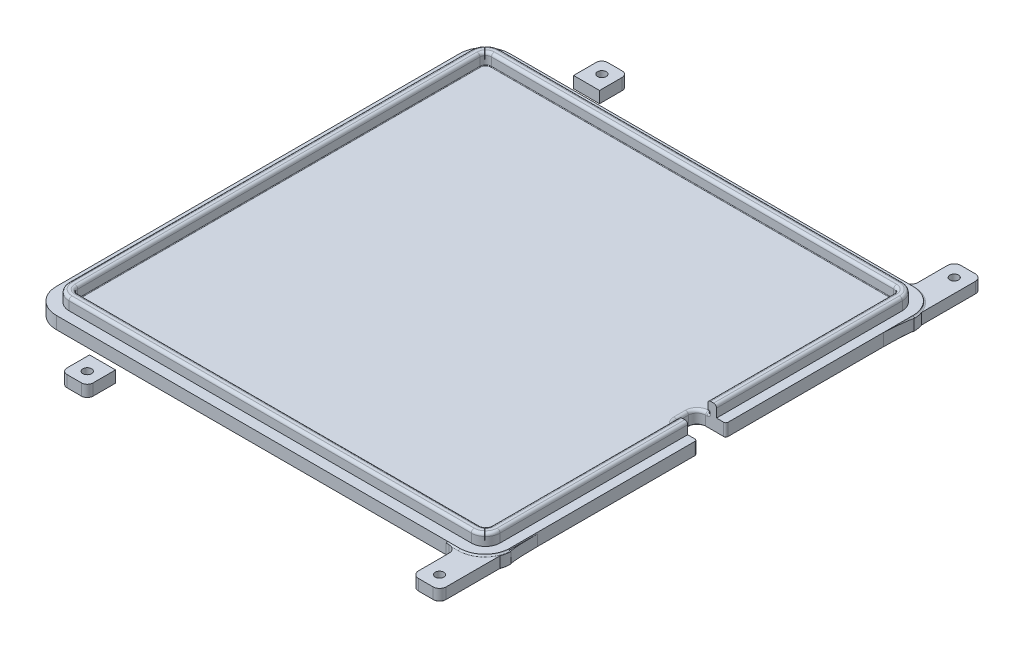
SolidWorks part; units mm, degrees
ref_plane "Front Plane" through (0, 0, 0) normal (0, 0, 1) x (1, 0, 0)
ref_plane "Top Plane" through (0, 0, 0) normal (0, 1, 0) x (1, 0, 0)
ref_plane "Right Plane" through (0, 0, 0) normal (1, 0, 0) x (0, 0, -1)
sketch "Sketch1" plane through (0, 0, 0) normal (0, 1, 0) x (1, 0, 0)
  line L8 (-70, -78.7) -> (70, -78.7)
  line L9 (78.7, -70) -> (78.7, 70)
  line L10 (70, 78.7) -> (-70, 78.7)
  line L11 (-78.7, 70) -> (-78.7, -70)
  line L12 (-70, 70) -> (70, -70) construction
  line L13 (70, -70) -> (70, 70) construction
  line L14 (70, 70) -> (-70, -70) construction
  arc A8 (-78.7, -70) -> (-70, -78.7) centre (-70, -70) ccw
  arc A9 (70, -78.7) -> (78.7, -70) centre (70, -70) ccw
  arc A10 (78.7, 70) -> (70, 78.7) centre (70, 70) ccw
  arc A11 (-70, 78.7) -> (-78.7, 70) centre (-70, 70) ccw
  point P13 (0, 0)
  dimension "D1" = 140
  dimension "D2" = 140
extrude "Boss-Extrude1" add sketch "Sketch1" along normal blind 4.5
sketch "Sketch2" plane through (0, 4.5, 0) normal (0, 1, 0) x (1, 0, 0)
  line L0 (-74.1708, 69.5068) -> (-74.1708, -70.1199)
  line L9 (-69.1708, -75.1199) -> (70.4559, -75.1199)
  line L12 (75.4559, -70.1199) -> (75.4559, 69.5068)
  line L15 (70.4559, 74.5068) -> (-69.1708, 74.5068)
  arc A11 (-74.1708, -70.1199) -> (-69.1708, -75.1199) centre (-69.1708, -70.1199) ccw
  arc A12 (75.4559, -70.1199) -> (70.4559, -75.1199) centre (70.4559, -70.1199) cw
  arc A13 (75.4559, 69.5068) -> (70.4559, 74.5068) centre (70.4559, 69.5068) ccw
  arc A14 (-74.1708, 69.5068) -> (-69.1708, 74.5068) centre (-69.1708, 69.5068) cw
  point P0 (0, 0)
  dimension "D1" = 5
extrude "Extrude-Thin1" add sketch "Sketch2" along normal blind 4 thin
fillet "Fillet1" radius 1 16 edges at (-71.1708, 8.5, 0.3065) (0.6426, 8.5, 72.1199) (72.4559, 8.5, 0.3065) (0.6426, 8.5, -71.5068) (0.6426, 8.5, -74.5068) (75.4559, 8.5, 0.3065) (0.6426, 8.5, 75.1199) (-74.1708, 8.5, 0.3065) (71.8701, 8.5, 71.5341) (71.8701, 8.5, -70.921) (-70.585, 8.5, -70.921) (-70.585, 8.5, 71.5341) (-72.7063, 8.5, -73.0423) (73.9915, 8.5, -73.0423) (73.9915, 8.5, 73.6554) (-72.7063, 8.5, 73.6554)
sketch "Sketch3" plane through (0, 8.5, 0) normal (0, 1, 0) x (1, 0, 0)
  line L0 (-75, 70) -> (-75, 75) construction
  line L1 (-70, 75) -> (-75, 75) construction
  line L2 (-75.0707, 74.9293) -> (-74.9293, 75.0707) construction
  line L3 (-75.0707, 74.9293) -> (78.5176, -78.659)
  line L4 (78.5176, -78.659) -> (78.659, -78.5176)
  line L5 (78.659, -78.5176) -> (-74.9293, 75.0707)
  line L6 (-74.9293, 75.0707) -> (-75.0707, 74.9293)
  point P10 (-75, 75)
extrude "Cut-Extrude1" cut sketch "Sketch3" against normal blind 3.8 draft 2.5
fillet "Fillet2" radius 0.2 8 edges at (-71.1708, 4.5, 0.3065) (-70.585, 4.5, -70.921) (0.6426, 4.5, -71.5068) (71.8701, 4.5, -70.921) (72.4559, 4.5, 0.3065) (71.8701, 4.5, 71.5341) (0.6426, 4.5, 72.1199) (-70.585, 4.5, 71.5341)
sketch "Sketch4" plane through (0, 0, 0) normal (0, -1, 0) x (1, 0, 0)
  line L63 (-66.7883, -91.5032) -> (-66.7883, -78.3901)
  line L64 (-66.7883, -78.3901) -> (-64.3539, -78.3901)
  line L65 (-64.3539, -78.3901) -> (-64.3539, -77.9901)
  line L66 (-64.3539, -77.9901) -> (-67.6539, -77.9901)
  line L67 (-67.6539, -77.9901) -> (-67.6539, -76.1401)
  line L68 (-67.6539, -76.1401) -> (-64.3539, -76.1401)
  line L69 (-64.3539, -76.1401) -> (65.9461, -76.1401)
  line L70 (65.9461, -76.1401) -> (68.9461, -76.1401)
  line L71 (68.9461, -76.1401) -> (68.9461, -77.9901)
  line L72 (68.9461, -77.9901) -> (65.9461, -77.9901)
  line L73 (65.9461, -77.9901) -> (65.6461, -77.9901)
  line L74 (65.6461, -77.9901) -> (65.6461, -78.3901)
  line L75 (65.6461, -78.3901) -> (69.1461, -78.3901)
  line L76 (69.1461, -78.3901) -> (69.1461, -91.5032)
  line L77 (71.4461, -93.8032) -> (76.4678, -93.8032)
  line L78 (78.7678, -91.5032) -> (78.7678, -72.8087)
  line L79 (79.3459, -69.6901) -> (79.3459, -64.6901)
  line L80 (79.3459, -64.6901) -> (78.9459, -64.6901)
  line L81 (78.9459, -64.6901) -> (78.9459, -64.9901)
  line L82 (78.9459, -64.9901) -> (78.9459, -67.9901)
  line L83 (78.9459, -67.9901) -> (77.0959, -67.9901)
  line L84 (77.0959, -67.9901) -> (77.0959, -64.9901)
  line L85 (77.0959, -64.9901) -> (77.0959, 65.6099)
  line L86 (77.0959, 65.6099) -> (77.0959, 68.6099)
  line L87 (77.0959, 68.6099) -> (78.9459, 68.6099)
  line L88 (78.9459, 68.6099) -> (78.9459, 65.6099)
  line L89 (78.9459, 65.6099) -> (78.9459, 65.3099)
  line L90 (78.9459, 65.3099) -> (79.3459, 65.3099)
  line L91 (79.3459, 65.3099) -> (79.3459, 70.3099)
  line L92 (78.7678, 73.4284) -> (78.7678, 92.1229)
  line L93 (76.4678, 94.4229) -> (71.4461, 94.4229)
  line L94 (69.1461, 92.1229) -> (69.1461, 79.0099)
  line L95 (69.1461, 79.0099) -> (65.6461, 79.0099)
  line L96 (65.6461, 79.0099) -> (65.6461, 78.6099)
  line L97 (65.6461, 78.6099) -> (65.9461, 78.6099)
  line L98 (65.9461, 78.6099) -> (68.9461, 78.6099)
  line L99 (68.9461, 78.6099) -> (68.9461, 76.7599)
  line L100 (68.9461, 76.7599) -> (65.9461, 76.7599)
  line L101 (65.9461, 76.7599) -> (-64.6539, 76.7599)
  line L102 (-64.6539, 76.7599) -> (-67.6539, 76.7599)
  line L103 (-67.6539, 76.7599) -> (-67.6539, 78.6099)
  line L104 (-67.6539, 78.6099) -> (-64.6539, 78.6099)
  line L105 (-64.6539, 78.6099) -> (-64.3539, 78.6099)
  line L106 (-64.3539, 78.6099) -> (-64.3539, 79.0099)
  line L107 (-64.3539, 79.0099) -> (-66.7883, 79.0099)
  line L108 (-66.7883, 79.0099) -> (-66.7883, 92.1229)
  line L109 (-69.0883, 94.4229) -> (-74.1099, 94.4229)
  line L110 (-76.4099, 92.1229) -> (-76.4099, 75.3996)
  line L111 (-78.0541, 70.3099) -> (-78.0541, 65.3099)
  line L112 (-78.0541, 65.3099) -> (-77.6541, 65.3099)
  line L113 (-77.6541, 65.3099) -> (-77.6541, 65.6099)
  line L114 (-77.6541, 65.6099) -> (-77.6541, 68.6099)
  line L115 (-77.6541, 68.6099) -> (-75.8041, 68.6099)
  line L116 (-75.8041, 68.6099) -> (-75.8041, 65.6099)
  line L117 (-75.8041, 65.6099) -> (-75.8041, -64.9901)
  line L118 (-75.8041, -64.9901) -> (-75.8041, -67.9901)
  line L119 (-75.8041, -67.9901) -> (-77.6541, -67.9901)
  line L120 (-77.6541, -67.9901) -> (-77.6541, -64.9901)
  line L121 (-77.6541, -64.9901) -> (-77.6541, -64.8901)
  line L122 (-77.6541, -64.8901) -> (-78.0541, -64.8901)
  line L123 (-78.0541, -64.8901) -> (-78.0541, -69.6901)
  line L124 (-76.4099, -74.7799) -> (-76.4099, -91.5032)
  line L125 (-74.1099, -93.8032) -> (-69.0883, -93.8032)
  line L126 (-66.7883, -91.5032) -> (-66.7883, -78.3901)
  line L127 (-66.7883, -78.3901) -> (-64.3539, -78.3901)
  line L128 (-64.3539, -78.3901) -> (-64.3539, -77.9901)
  line L129 (-64.3539, -77.9901) -> (-67.6539, -77.9901)
  line L130 (-67.6539, -77.9901) -> (-67.6539, -76.1401)
  line L131 (-67.6539, -76.1401) -> (-64.3539, -76.1401)
  line L132 (-64.3539, -76.1401) -> (65.9461, -76.1401)
  line L133 (65.9461, -76.1401) -> (68.9461, -76.1401)
  line L134 (68.9461, -76.1401) -> (68.9461, -77.9901)
  line L135 (68.9461, -77.9901) -> (65.9461, -77.9901)
  line L136 (65.9461, -77.9901) -> (65.6461, -77.9901)
  line L137 (65.6461, -77.9901) -> (65.6461, -78.3901)
  line L138 (65.6461, -78.3901) -> (69.1461, -78.3901)
  line L139 (69.1461, -78.3901) -> (69.1461, -91.5032)
  line L140 (71.4461, -93.8032) -> (76.4678, -93.8032)
  line L141 (78.7678, -91.5032) -> (78.7678, -72.8087)
  line L142 (79.3459, -69.6901) -> (79.3459, -64.6901)
  line L143 (79.3459, -64.6901) -> (78.9459, -64.6901)
  line L144 (78.9459, -64.6901) -> (78.9459, -64.9901)
  line L145 (78.9459, -64.9901) -> (78.9459, -67.9901)
  line L146 (78.9459, -67.9901) -> (77.0959, -67.9901)
  line L147 (77.0959, -67.9901) -> (77.0959, -64.9901)
  line L148 (77.0959, -64.9901) -> (77.0959, 65.6099)
  line L149 (77.0959, 65.6099) -> (77.0959, 68.6099)
  line L150 (77.0959, 68.6099) -> (78.9459, 68.6099)
  line L151 (78.9459, 68.6099) -> (78.9459, 65.6099)
  line L152 (78.9459, 65.6099) -> (78.9459, 65.3099)
  line L153 (78.9459, 65.3099) -> (79.3459, 65.3099)
  line L154 (79.3459, 65.3099) -> (79.3459, 70.3099)
  line L155 (78.7678, 73.4284) -> (78.7678, 92.1229)
  line L156 (76.4678, 94.4229) -> (71.4461, 94.4229)
  line L157 (69.1461, 92.1229) -> (69.1461, 79.0099)
  line L158 (69.1461, 79.0099) -> (65.6461, 79.0099)
  line L159 (65.6461, 79.0099) -> (65.6461, 78.6099)
  line L160 (65.6461, 78.6099) -> (65.9461, 78.6099)
  line L161 (65.9461, 78.6099) -> (68.9461, 78.6099)
  line L162 (68.9461, 78.6099) -> (68.9461, 76.7599)
  line L163 (68.9461, 76.7599) -> (65.9461, 76.7599)
  line L164 (65.9461, 76.7599) -> (-64.6539, 76.7599)
  line L165 (-64.6539, 76.7599) -> (-67.6539, 76.7599)
  line L166 (-67.6539, 76.7599) -> (-67.6539, 78.6099)
  line L167 (-67.6539, 78.6099) -> (-64.6539, 78.6099)
  line L168 (-64.6539, 78.6099) -> (-64.3539, 78.6099)
  line L169 (-64.3539, 78.6099) -> (-64.3539, 79.0099)
  line L170 (-64.3539, 79.0099) -> (-66.7883, 79.0099)
  line L171 (-66.7883, 79.0099) -> (-66.7883, 92.1229)
  line L172 (-69.0883, 94.4229) -> (-74.1099, 94.4229)
  line L173 (-76.4099, 92.1229) -> (-76.4099, 75.3996)
  line L174 (-78.0541, 70.3099) -> (-78.0541, 65.3099)
  line L175 (-78.0541, 65.3099) -> (-77.6541, 65.3099)
  line L176 (-77.6541, 65.3099) -> (-77.6541, 65.6099)
  line L177 (-77.6541, 65.6099) -> (-77.6541, 68.6099)
  line L178 (-77.6541, 68.6099) -> (-75.8041, 68.6099)
  line L179 (-75.8041, 68.6099) -> (-75.8041, 65.6099)
  line L180 (-75.8041, 65.6099) -> (-75.8041, -64.9901)
  line L181 (-75.8041, -64.9901) -> (-75.8041, -67.9901)
  line L182 (-75.8041, -67.9901) -> (-77.6541, -67.9901)
  line L183 (-77.6541, -67.9901) -> (-77.6541, -64.9901)
  line L184 (-77.6541, -64.9901) -> (-77.6541, -64.8901)
  line L185 (-77.6541, -64.8901) -> (-78.0541, -64.8901)
  line L186 (-78.0541, -64.8901) -> (-78.0541, -69.6901)
  line L187 (-76.4099, -74.7799) -> (-76.4099, -91.5032)
  line L188 (-74.1099, -93.8032) -> (-69.0883, -93.8032)
  arc A12 (69.1461, -91.5032) -> (71.4461, -93.8032) centre (71.4461, -91.5032) ccw
  arc A13 (76.4678, -93.8032) -> (78.7678, -91.5032) centre (76.4678, -91.5032) ccw
  arc A14 (78.7678, -72.8087) -> (79.3459, -69.6901) centre (70.6459, -69.6901) ccw
  arc A15 (79.3459, 70.3099) -> (78.7678, 73.4284) centre (70.6459, 70.3099) ccw
  arc A16 (78.7678, 92.1229) -> (76.4678, 94.4229) centre (76.4678, 92.1229) ccw
  arc A17 (71.4461, 94.4229) -> (69.1461, 92.1229) centre (71.4461, 92.1229) ccw
  arc A18 (-66.7883, 92.1229) -> (-69.0883, 94.4229) centre (-69.0883, 92.1229) ccw
  arc A19 (-74.1099, 94.4229) -> (-76.4099, 92.1229) centre (-74.1099, 92.1229) ccw
  arc A20 (-76.4099, 75.3996) -> (-78.0541, 70.3099) centre (-69.3541, 70.3099) ccw
  arc A21 (-78.0541, -69.6901) -> (-76.4099, -74.7799) centre (-69.3541, -69.6901) ccw
  arc A22 (-76.4099, -91.5032) -> (-74.1099, -93.8032) centre (-74.1099, -91.5032) ccw
  arc A23 (-69.0883, -93.8032) -> (-66.7883, -91.5032) centre (-69.0883, -91.5032) ccw
  arc A24 (69.1461, -91.5032) -> (71.4461, -93.8032) centre (71.4461, -91.5032) ccw
  arc A25 (76.4678, -93.8032) -> (78.7678, -91.5032) centre (76.4678, -91.5032) ccw
  arc A26 (78.7678, -72.8087) -> (79.3459, -69.6901) centre (70.6459, -69.6901) ccw
  arc A27 (79.3459, 70.3099) -> (78.7678, 73.4284) centre (70.6459, 70.3099) ccw
  arc A28 (78.7678, 92.1229) -> (76.4678, 94.4229) centre (76.4678, 92.1229) ccw
  arc A29 (71.4461, 94.4229) -> (69.1461, 92.1229) centre (71.4461, 92.1229) ccw
  arc A30 (-66.7883, 92.1229) -> (-69.0883, 94.4229) centre (-69.0883, 92.1229) ccw
  arc A31 (-74.1099, 94.4229) -> (-76.4099, 92.1229) centre (-74.1099, 92.1229) ccw
  arc A32 (-76.4099, 75.3996) -> (-78.0541, 70.3099) centre (-69.3541, 70.3099) ccw
  arc A33 (-78.0541, -69.6901) -> (-76.4099, -74.7799) centre (-69.3541, -69.6901) ccw
  arc A34 (-76.4099, -91.5032) -> (-74.1099, -93.8032) centre (-74.1099, -91.5032) ccw
  arc A35 (-69.0883, -93.8032) -> (-66.7883, -91.5032) centre (-69.0883, -91.5032) ccw
  dimension "D1" = 0
extrude "Boss-Extrude2" add sketch "Sketch4" against normal blind 4
fillet "Fillet4" radius 0.5 5 edges at (-70, 4.25, 78.7) (-67.1769, 4, 78.7) (-73.5009, 4, 77.9645) (-64.3539, 4, 78.8549) (-65.5711, 4, 79.0099)
fillet "Fillet6" radius 0.5 9 edges at (78.7, 4.25, 70) (70, 4.25, 78.7) (76.1518, 4, 76.1518) (67.8231, 4, 78.7) (78.7, 4, 69.3049) (65.6461, 4, 78.8549) (78.823, 4, 68.6099) (67.3961, 4, 79.0099) (78.9459, 4, 66.9599)
fillet "Fillet7" radius 0.5 7 edges at (70, 4.25, -78.7) (78.7, 4.25, -70) (76.1518, 4, -76.1518) (78.7, 4, -68.9951) (69.5731, 4, -78.7) (78.823, 4, -67.9901) (78.9459, 4, -66.3401)
fillet "Fillet8" radius 0.5 3 edges at (-70, 4.25, -78.7) (-73.5009, 4, -77.9645) (-68.3941, 4, -78.7)
fillet "Fillet9" radius 2.5 6 edges at (-76.4099, 2.25, 75.8824) (-66.7883, 2.0188, 79.0099) (69.1461, 2.0188, 79.0099) (69.1461, 2.25, -78.7) (-66.7883, 2.25, -78.7) (-76.4099, 2.25, -75.8824)
sketch "Sketch5" plane through (0, 0, 0) normal (0, -1, 0) x (1, 0, 0)
  circle A0 centre (-71.5991, -89.0032) radius 1.5 construction
  circle A1 centre (73.957, -89.0032) radius 1.5 construction
  circle A2 centre (73.957, 89.6229) radius 1.5 construction
  circle A3 centre (-71.5991, 89.6229) radius 1.5 construction
  circle A4 centre (-71.5991, -89.0032) radius 1.5
  circle A5 centre (73.957, -89.0032) radius 1.5
  circle A6 centre (73.957, 89.6229) radius 1.5
  circle A7 centre (-71.5991, 89.6229) radius 1.5
extrude "Cut-Extrude2" cut sketch "Sketch5" against normal blind 4
sketch "Sketch6" plane through (78.7, 0, 0) normal (1, 0, 0) x (0, 0, -1)
  line L0 (-5, 0) -> (5, 0) construction
  line L4 (-5, 0) -> (5, 0)
  line L5 (-5, 0) -> (-5, 8.5)
  line L6 (-5, 8.5) -> (5, 8.5)
  line L7 (5, 0) -> (5, 8.5)
  line L8 (-5, 0) -> (5, 8.5) construction
  line L9 (-5, 8.5) -> (5, 0) construction
  line L10 (-70.1199, 8.5) -> (69.5068, 8.5) construction
  line L11 (-68.6099, 0) -> (67.9901, 0) construction
  point P6 (0, 0)
  point P10 (0, 4.25)
  dimension "D1" = 10
extrude "Cut-Extrude3" cut sketch "Sketch6" against normal blind 10
fillet "Fillet10" radius 3 2 edges at (68.7, 2.25, 5) (68.7, 2.25, -5)
fillet "Fillet11" radius 0.75 2 edges at (78.7, 2.25, -5) (78.7, 2.25, 5)
fillet "Fillet12" radius 1 3 edges at (69.5787, 4.5, -4.1213) (69.5787, 4.5, 4.1213) (68.7, 4.5, 0)
sketch "Sketch7" plane through (0, 4.5, 0) normal (0, 1, 0) x (1, 0, 0)
  line L0 (79.3459, 69.6901) -> (79.3459, 64.6901) construction
  line L1 (78.7, 69.6901) -> (79.3459, 69.6901)
  line L2 (78.7, 69.6901) -> (78.7, 63.8052)
  line L3 (78.7, 63.8052) -> (79.3459, 63.8052)
  line L4 (79.3459, 69.6901) -> (79.3459, 63.8052)
  line L5 (78.7, 69.6901) -> (79.3459, 63.8052) construction
  line L6 (78.7, 63.8052) -> (79.3459, 69.6901) construction
  line L7 (78.7, -70.3099) -> (79.3459, -70.3099)
  line L8 (78.7, -70.3099) -> (78.7, -64.458)
  line L9 (78.7, -64.458) -> (79.3459, -64.458)
  line L10 (79.3459, -70.3099) -> (79.3459, -64.458)
  line L11 (78.7, -70.3099) -> (79.3459, -64.458) construction
  line L12 (78.7, -64.458) -> (79.3459, -70.3099) construction
  line L13 (79.3459, 69.6901) -> (79.3459, 64.6901) construction
  line L14 (79.3459, -65.3099) -> (79.3459, -70.3099) construction
  line L15 (79.3459, -65.3099) -> (79.3459, -70.3099) construction
  line L16 (78.7, -68.6099) -> (78.7, -5.75) construction
  line L17 (78.7, 67.9901) -> (78.7, 70) construction
  point P4 (79.023, 66.7477)
  point P10 (79.023, -67.3839)
extrude "Cut-Extrude4" cut sketch "Sketch7" against normal blind 10
fillet "Fillet17" radius 10 2 edges at (78.7, 0, 38.0299) (79.023, 0, 70.3099)
fillet "Fillet19" radius 10 4 edges at (79.273, 4, -69.6901) (79.023, 0, -69.6901) (78.7, 2.25, -69.6901) (78.8464, 4.1464, -69.6901)
sketch "Sketch8" plane through (0, 4.5, 0) normal (0, 1, 0) x (1, 0, 0)
  line L0 (-64.3539, -78.7) -> (-70, -78.7)
  line L1 (-76.4174, -76.5921) -> (-76.4174, -98.7294)
  line L2 (-76.4174, -98.7294) -> (-59.4049, -98.7294)
  line L3 (-59.4049, -98.7294) -> (-59.4049, -78.7)
  line L4 (-64.3539, -78.7) -> (65.6461, -78.7) construction
  line L5 (-59.4049, -78.7) -> (-64.3539, -78.7)
  line L6 (-64.2883, 78.7) -> (-64.2883, 95.5579)
  line L7 (-64.2883, 95.5579) -> (-76.574, 95.5579)
  line L8 (-76.574, 95.5579) -> (-76.9211, 75.2715)
  line L9 (-64.2883, 78.7) -> (-70, 78.7) construction
  line L10 (-64.2883, 78.7) -> (-70, 78.7)
  arc A0 (-76.9211, -75.2715) -> (-70, -78.7) centre (-70, -70) ccw construction
  arc A1 (-76.9211, -75.2715) -> (-70, -78.7) centre (-70, -70) ccw
  arc A2 (-76.4174, -76.5921) -> (-76.9211, -75.2715) centre (-78.9099, -76.7863) ccw construction
  arc A3 (-76.4174, -76.5921) -> (-76.9211, -75.2715) centre (-78.9099, -76.7863) ccw
  arc A4 (-70, 78.7) -> (-76.9211, 75.2715) centre (-70, 70) ccw construction
  arc A5 (-70, 78.7) -> (-76.9211, 75.2715) centre (-70, 70) ccw
extrude "Cut-Extrude5" cut sketch "Sketch8" against normal blind 10
chamfer "Chamfer1" distance 0.2 angle 45 34 edges at (73.957, 0, -90.5032) (73.957, 0, 88.1229) (78.7678, 0, -82.1559) (78.0941, 0, -93.1295) (73.957, 0, -93.8032) (69.8198, 0, -93.1295) (69.1461, 0, -86.3516) (68.4139, 0, -79.4322) (-1.6769, 0, -78.7) (-76.1518, 0, -76.1518) (-78.7, 0, 0) (-76.1518, 0, 76.1518) (-2.1769, 0, 78.7) (65.6461, 0, 78.8549) (66.1461, 0, 79.0099) (68.4139, 0, 79.7421) (69.1461, 0, 86.8164) (69.8198, 0, 93.7493) (73.957, 0, 94.4229) (78.0941, 0, 93.7493) (78.7678, 0, 82.7757) (78.4803, 0, 5.2197) (74.825, 0, 5) (69.5787, 0, 4.1213) (68.7, 0, 0) (69.5787, 0, -4.1213) (74.825, 0, -5) (78.4803, 0, -5.2197)
sketch "Sketch14" plane through (0, 0, 0) normal (0, -1, 0) x (1, 0, 0)
  line L5 (-43.8325, 84.3099) -> (-43.8325, 92.1229)
  line L6 (-43.8325, 84.3099) -> (-43.8325, 92.1229)
  line L7 (-52.8541, 84.3099) -> (-43.8325, 84.3099)
  line L8 (-52.8541, 84.3099) -> (-43.8325, 84.3099)
  line L9 (-52.8541, 92.1229) -> (-52.8541, 84.3099)
  line L15 (-43.8325, -83.6901) -> (-52.8541, -83.6901)
  line L16 (-43.8325, -83.6901) -> (-52.8541, -83.6901)
  line L17 (-43.8325, -91.5032) -> (-43.8325, -83.6901)
  line L18 (-43.8325, -91.5032) -> (-43.8325, -83.6901)
  line L19 (-50.8541, -93.5032) -> (-45.8325, -93.5032)
  line L31 (-52.8541, 92.1229) -> (-52.8541, 84.3099)
  line L32 (-45.8325, 94.1229) -> (-50.8541, 94.1229)
  line L33 (-45.8325, 94.1229) -> (-50.8541, 94.1229)
  line L34 (-50.8541, -93.5032) -> (-45.8325, -93.5032)
  line L35 (-52.8541, -83.6901) -> (-52.8541, -91.5032)
  line L36 (-52.8541, -83.6901) -> (-52.8541, -91.5032)
  circle A0 centre (-48.3433, -89.0032) radius 1.5 construction
  circle A1 centre (-48.3433, -89.0032) radius 1.5
  circle A10 centre (-48.3433, 89.6229) radius 1.5 construction
  circle A11 centre (-48.3433, 89.6229) radius 1.5
  arc A14 (-43.8325, 92.1229) -> (-45.8325, 94.1229) centre (-45.8325, 92.1229) ccw
  arc A15 (-43.8325, 92.1229) -> (-45.8325, 94.1229) centre (-45.8325, 92.1229) ccw
  arc A16 (-50.8541, 94.1229) -> (-52.8541, 92.1229) centre (-50.8541, 92.1229) ccw
  arc A18 (-50.8541, 94.1229) -> (-52.8541, 92.1229) centre (-50.8541, 92.1229) ccw
  arc A20 (-45.8325, -93.5032) -> (-43.8325, -91.5032) centre (-45.8325, -91.5032) ccw
  arc A21 (-45.8325, -93.5032) -> (-43.8325, -91.5032) centre (-45.8325, -91.5032) ccw
  arc A22 (-52.8541, -91.5032) -> (-50.8541, -93.5032) centre (-50.8541, -91.5032) ccw
  arc A23 (-52.8541, -91.5032) -> (-50.8541, -93.5032) centre (-50.8541, -91.5032) ccw
  dimension "D1" = 0
  dimension "D2" = 0
extrude "Boss-Extrude3" add sketch "Sketch14" against normal up to surface (4 mm away)
